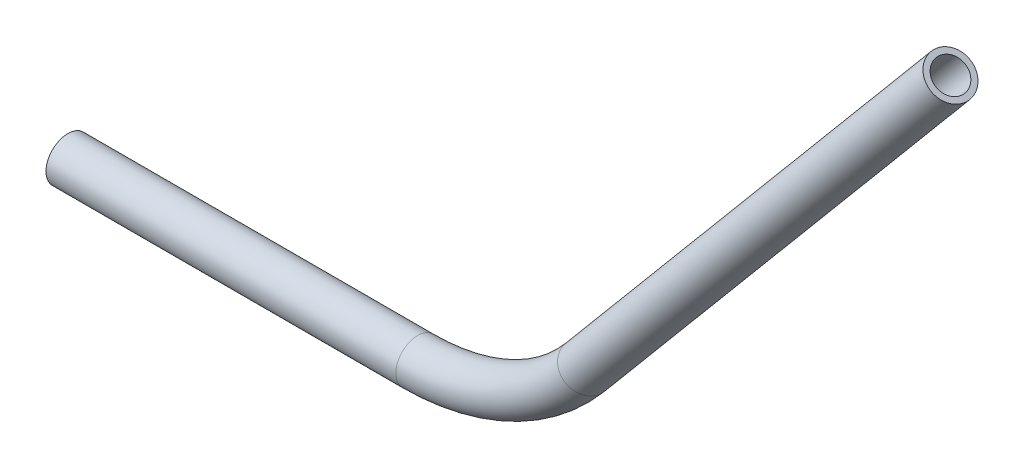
SolidWorks part; units mm, degrees
ref_plane "Front Plane" through (0, 0, 0) normal (0, 0, 1) x (1, 0, 0)
ref_plane "Top Plane" through (0, 0, 0) normal (0, 1, 0) x (1, 0, 0)
ref_plane "Right Plane" through (0, 0, 0) normal (1, 0, 0) x (0, 0, -1)
sketch "Sketch1" plane through (0, 0, 0) normal (0, 0, 1) x (1, 0, 0)
  line L0 (0, 0) -> (101.6, 0)
  line L1 (150.2438, 22.683) -> (256.3681, 149.1569)
  arc A0 (101.6, 0) -> (150.2438, 22.683) centre (101.6, 63.5) ccw
  dimension "D1" = 63.5
  dimension "D2" = 165.1
  dimension "D3" = 101.6
  dimension "D4" = 130
sketch "Sketch2" plane through (0, 0, 0) normal (1, 0, 0) x (0, 0, -1)
  circle A0 centre (0, 0) radius 6.35
  dimension "D1" = 12.7
sketch "Sketch3" plane through (0, 0, 0) normal (0, 0, 1) x (1, 0, 0)
  line L0 (0, 0) -> (101.6, 0) construction
  line L1 (150.2438, 22.683) -> (256.3681, 149.1569) construction
  line L2 (0, 0) -> (101.6, 0)
  line L3 (150.2438, 22.683) -> (256.3681, 149.1569)
  arc A0 (101.6, 0) -> (150.2438, 22.683) centre (101.6, 63.5) ccw construction
  arc A1 (101.6, 0) -> (150.2438, 22.683) centre (101.6, 63.5) ccw
sweep "Sweep-Thin1" add profiles "Sketch2" path "Sketch3" parameters "D1"=1.651
